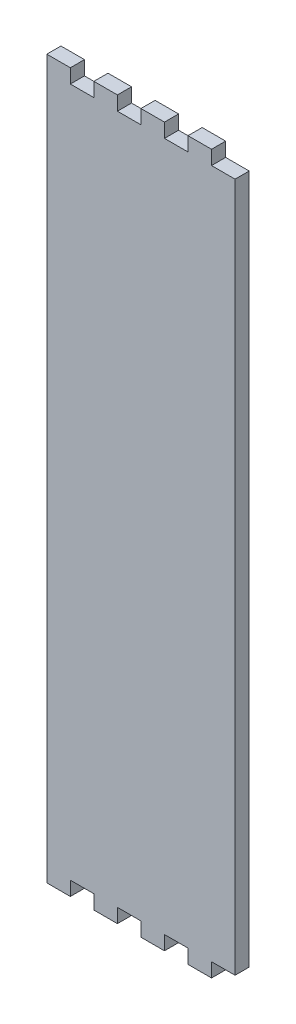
SolidWorks part; units mm, degrees
ref_plane "Piano frontale" through (0, 0, 0) normal (0, 0, 1) x (1, 0, 0)
ref_plane "Piano superiore" through (0, 0, 0) normal (0, 1, 0) x (1, 0, 0)
ref_plane "Piano destro" through (0, 0, 0) normal (1, 0, 0) x (0, 0, -1)
sketch "Schizzo1" plane through (0, 0, 0) normal (0, 0, 1) x (1, 0, 0)
  line L0 (-20, 152.5) -> (-20, 146.5)
  line L1 (-40, 152.5) -> (-30, 152.5)
  line L2 (-40, 152.5) -> (-40, -152.5)
  line L3 (-40, -152.5) -> (-30, -152.5)
  line L4 (40, 146.5) -> (40, -146.5)
  line L5 (0, 152.5) -> (10, 152.5)
  line L6 (-30, 152.5) -> (-30, 146.5)
  line L7 (-30, 146.5) -> (-20, 146.5)
  line L8 (-20, 152.5) -> (-20, 146.5)
  line L9 (-10, 152.5) -> (-10, 146.5)
  line L10 (-20, 146.5) -> (-10, 146.5)
  line L11 (-10, 152.5) -> (-10, 146.5)
  line L12 (0, 152.5) -> (0, 146.5)
  line L13 (-10, 146.5) -> (0, 146.5)
  line L14 (0, 152.5) -> (0, 146.5)
  line L15 (10, 152.5) -> (10, 146.5)
  line L16 (0, 146.5) -> (10, 146.5)
  line L17 (10, 152.5) -> (10, 146.5)
  line L18 (20, 152.5) -> (20, 146.5)
  line L19 (10, 146.5) -> (20, 146.5)
  line L20 (20, 152.5) -> (20, 146.5)
  line L21 (30, 152.5) -> (30, 146.5)
  line L22 (20, 146.5) -> (30, 146.5)
  line L23 (30, 152.5) -> (30, 146.5)
  line L24 (-40, 0) -> (40, 0) construction
  line L25 (30, 146.5) -> (40, 146.5)
  line L26 (-20, 152.5) -> (-10, 152.5)
  line L27 (20, 152.5) -> (30, 152.5)
  line L28 (40, 152.5) -> (40, 146.5)
  line L29 (30, -146.5) -> (40, -146.5)
  line L30 (30, -152.5) -> (30, -146.5)
  line L31 (20, -152.5) -> (20, -146.5)
  line L32 (10, -146.5) -> (20, -146.5)
  line L33 (10, -152.5) -> (10, -146.5)
  line L34 (0, -152.5) -> (0, -146.5)
  line L35 (-10, -146.5) -> (0, -146.5)
  line L36 (-10, -152.5) -> (-10, -146.5)
  line L37 (-20, -152.5) -> (-20, -146.5)
  line L38 (-30, -146.5) -> (-20, -146.5)
  line L39 (-30, -152.5) -> (-30, -146.5)
  line L40 (-20, -152.5) -> (-10, -152.5)
  line L41 (0, -152.5) -> (10, -152.5)
  line L42 (20, -152.5) -> (30, -152.5)
  dimension "D1" = 305
  dimension "D2" = 10
  dimension "D3" = 10
  dimension "D4" = 6
  dimension "D5" = 7
extrude "Estrusione-Estrusione1" add sketch "Schizzo1" along normal blind 6
